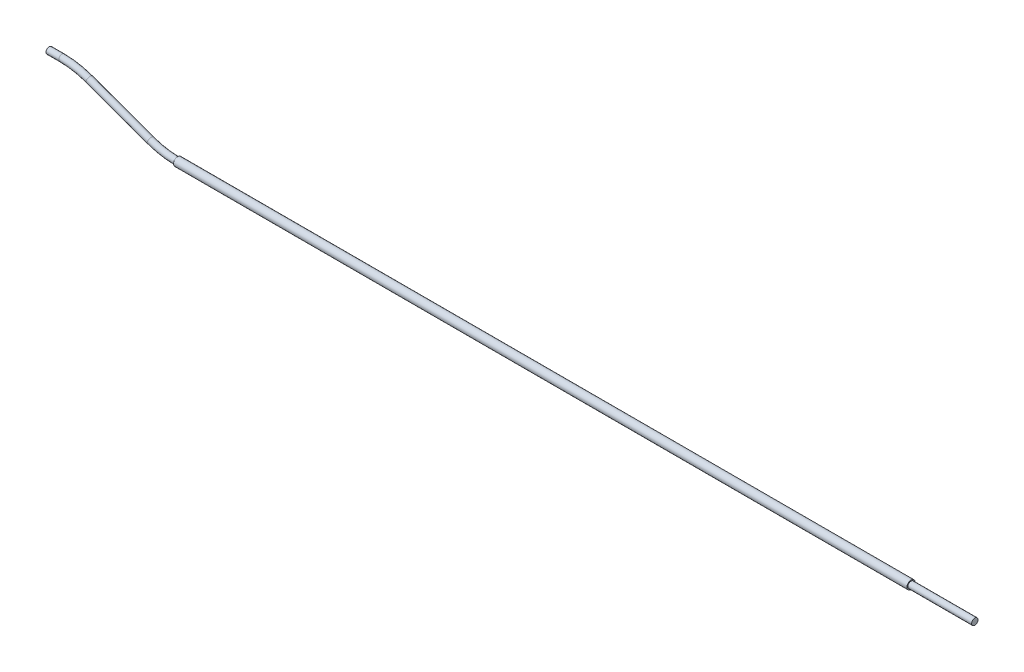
SolidWorks part; units mm, degrees
ref_plane "Front Plane" through (0, 0, 0) normal (0, 0, 1) x (1, 0, 0)
ref_plane "Top Plane" through (0, 0, 0) normal (0, 1, 0) x (1, 0, 0)
ref_plane "Right Plane" through (0, 0, 0) normal (1, 0, 0) x (0, 0, -1)
sketch "Sketch1" plane through (0, 0, 0) normal (1, 0, 0) x (0, 0, -1)
  circle A0 centre (0, 0) radius 0.127
  dimension "D1" = 0.254
sketch "Sketch2" plane through (0, 0, 0) normal (0, 0, 1) x (1, 0, 0)
  line L0 (0, 0) -> (-31.75, 0)
  line L1 (-32.8359, 0.1915) -> (-35.2731, 1.0785)
  arc A0 (-31.75, 0) -> (-32.8359, 0.1915) centre (-31.75, 3.175) cw
  arc A1 (-35.2731, 1.0785) -> (-36.359, 1.27) centre (-36.359, -1.905) ccw
  dimension "D1" = 3.175
  dimension "D3" = 3.175
  dimension "D2" = 1.27
  dimension "D4" = 31.75
  dimension "D5" = 20
sweep "Sweep1" add profiles "Sketch1" path "Sketch2"
sketch "Sketch3" plane through (0, 0, 0) normal (1, 0, 0) x (0, 0, -1)
  circle A0 centre (0, 0) radius 0.127 construction
  circle A1 centre (0, 0) radius 0.127
  circle A2 centre (0, 0) radius 0.1651
  dimension "D1" = 0.3302
extrude "Boss-Extrude1" add sketch "Sketch3" against normal blind 29.21 from offset 2.54 separate body
sketch "Sketch4" plane through (-36.359, 0, 0) normal (-1, 0, 0) x (0, 0, 1)
  circle A1 centre (0, 1.27) radius 0.127
  circle A2 centre (0, 1.27) radius 0.127
  dimension "D1" = 0
extrude "Boss-Extrude2" add sketch "Sketch4" along normal blind 0.508
